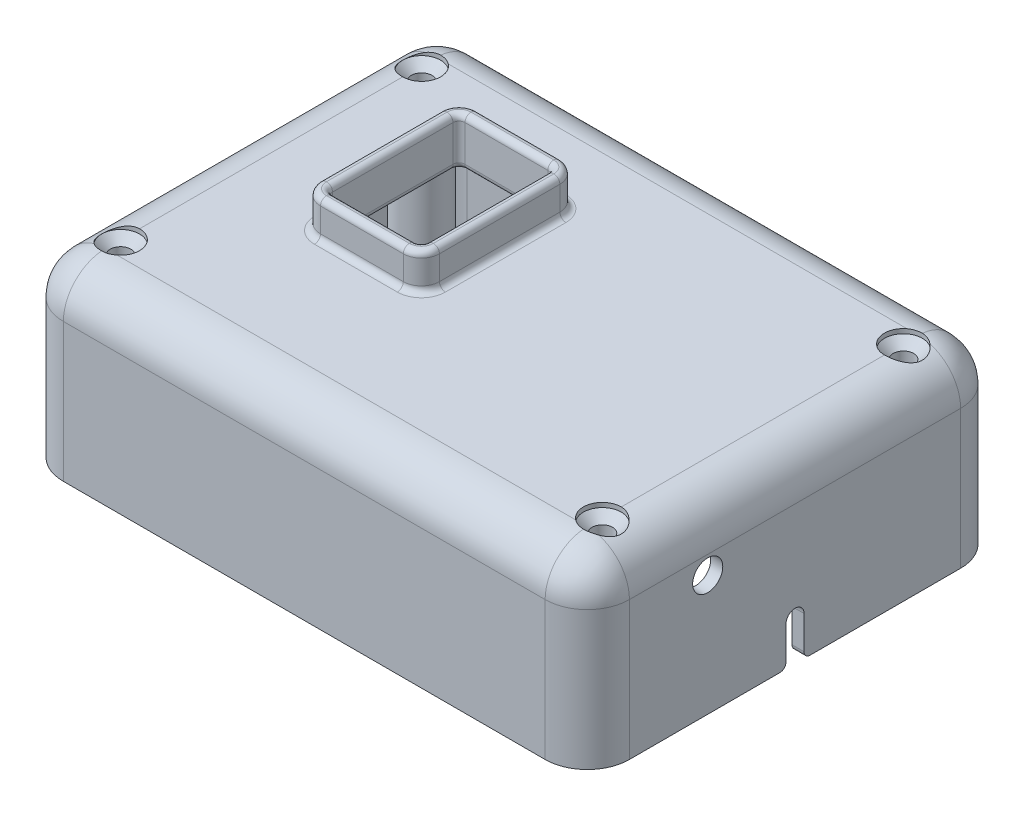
SolidWorks part; units mm, degrees
ref_plane "Front Plane" through (0, 0, 0) normal (0, 0, 1) x (1, 0, 0)
ref_plane "Top Plane" through (0, 0, 0) normal (0, 1, 0) x (1, 0, 0)
ref_plane "Right Plane" through (0, 0, 0) normal (1, 0, 0) x (0, 0, -1)
sketch "Sketch1" plane through (0, 0, 0) normal (0, 1, 0) x (1, 0, 0)
  line L1 (-47, -34.5) -> (47, -34.5)
  line L2 (-47, -34.5) -> (-47, 34.5)
  line L3 (-47, 34.5) -> (47, 34.5)
  line L4 (47, -34.5) -> (47, 34.5)
  line L5 (-47, -34.5) -> (47, 34.5) construction
  line L6 (-47, 34.5) -> (47, -34.5) construction
  point P0 (0, 0)
  dimension "D1" = 94
  dimension "D2" = 69
extrude "Boss-Extrude1" add sketch "Sketch1" along normal blind 30
fillet "Fillet1" radius 7 8 edges at (0, 30, 34.5) (-47, 30, 0) (0, 30, -34.5) (47, 30, 0) (-47, 15, -34.5) (47, 15, -34.5) (47, 15, 34.5) (-47, 15, 34.5)
shell "Shell1" thickness 2
sketch "Sketch2" plane through (47, 0, 0) normal (1, 0, 0) x (0, 0, -1)
  line L0 (-1.5, 6.5) -> (-1.5, 0)
  line L1 (-27.5, 0) -> (27.5, 0) construction
  line L2 (-1.5, 0) -> (1.5, 0)
  line L3 (1.5, 0) -> (1.5, 6.5)
  arc A0 (1.5, 6.5) -> (-1.5, 6.5) centre (0, 6.5) ccw
  point P7 (0, 0)
  dimension "D1" = 1.5
  dimension "D2" = 6.5
extrude "Cut-Extrude1" cut sketch "Sketch2" against normal blind 30
sketch "Sketch3" plane through (0, 0, 0) normal (0, -1, 0) x (1, 0, 0)
  circle A0 centre (40, -25) radius 4
  circle A1 centre (-40, -25) radius 4
  circle A2 centre (-40, 25) radius 4
  circle A3 centre (40, 25) radius 4
  dimension "D3" = 8
  dimension "D1" = 40
  dimension "D2" = 25
  dimension "D4" = 2
  dimension "D5" = 2
extrude "Boss-Extrude2" add sketch "Sketch3" against normal up to next
hole_wizard "CSK for M3 Flat Head Machine Screw1" positions "Sketch4" profile "Sketch5" countersink size "M3" standard "ANSI Metric"
sketch "Sketch4" plane through (0, 30, 0) normal (0, 1, 0) x (1, 0, 0)
  circle A0 centre (-40, 25) radius 4 construction
  circle A1 centre (-40, -25) radius 4 construction
  circle A2 centre (40, -25) radius 4 construction
  circle A3 centre (40, 25) radius 4 construction
  point P0 (-40, 25)
  point P2 (40, 25)
  point P4 (40, -25)
  point P6 (-40, -25)
sketch "Sketch5" plane through (-40, 30, -25) normal (1, 0, 0) x (0, 0, 1)
  line L0 (0, 0) -> (0, 30)
  line L1 (0, 30) -> (1.7, 30)
  line L2 (1.7, 30) -> (1.7, 2.2)
  line L3 (1.7, 2.2) -> (3.15, 0.75)
  line L4 (3.15, 0.75) -> (3.15, 0)
  line L6 (3.15, 0) -> (0, 0)
  line L7 (-1.7, 2.2) -> (-3.15, 0.75) construction
  line L11 (0, -6.35) -> (0, 107.95) construction
  dimension "Thru Hole Dia." = 3.4
  dimension "Thru Hole Depth" = 30
  dimension "C'Sink Dia." = 6.3
  dimension "C'Sink Angle" = 90
  dimension "Head Clearance" = 0.75
fillet "Fillet2" radius 1 2 edges at (46, 0, 1.5) (46, 0, -1.5)
sketch "Sketch6" plane through (0, 30, 0) normal (0, 1, 0) x (1, 0, 0)
  line L0 (40, 34.5) -> (-40, 34.5) construction
  line L1 (-8.5, 15.45) -> (-24.25, 15.45)
  line L2 (-8.5, 15.45) -> (-8.5, -6.55)
  line L3 (-8.5, -6.55) -> (-24.25, -6.55)
  line L4 (-24.25, 15.45) -> (-24.25, -6.55)
  line L5 (-47, 27.5) -> (-47, -27.5) construction
  dimension "D1" = 15.75
  dimension "D2" = 22
  dimension "D3" = 19.05
  dimension "D4" = 22.75
extrude "Cut-Extrude2" cut sketch "Sketch6" against normal up to next
sketch "Sketch7" plane through (0, 30, 0) normal (0, 1, 0) x (1, 0, 0)
  line L0 (-26.25, -8.55) -> (-26.25, 17.45)
  line L1 (-24.25, -6.55) -> (-8.5, -6.55)
  line L2 (-24.25, -6.55) -> (-24.25, 15.45)
  line L3 (-24.25, 15.45) -> (-8.5, 15.45)
  line L4 (-8.5, -6.55) -> (-8.5, 15.45)
  line L5 (-26.25, 17.45) -> (-6.5, 17.45)
  line L6 (-6.5, -8.55) -> (-6.5, 17.45)
  line L7 (-26.25, -8.55) -> (-6.5, -8.55)
  dimension "D1" = 2
extrude "Boss-Extrude3" add sketch "Sketch7" along normal blind 6
fillet "Fillet4" radius 3 4 edges at (-26.25, 33, -17.45) (-6.5, 33, -17.45) (-6.5, 33, 8.55) (-26.25, 33, 8.55)
fillet "Fillet3" radius 1 4 edges at (-8.5, 32, -15.45) (-24.25, 32, -15.45) (-24.25, 32, 6.55) (-8.5, 32, 6.55)
fillet "Fillet5" radius 1 32 edges at (-8.5, 28, -4.45) (-8.7929, 28, 6.2571) (-16.375, 28, 6.55) (-23.9571, 28, 6.2571) (-24.25, 28, -4.45) (-23.9571, 28, -15.1571) (-16.375, 28, -15.45) (-16.375, 30, -17.45) (-25.3713, 30, -16.5713) (-26.25, 30, -4.45) (-25.3713, 30, 7.6713) (-16.375, 30, 8.55) (-7.3787, 30, 7.6713) (-6.5, 30, -4.45) (-8.7929, 36, 6.2571) (-8.5, 36, -4.45) (-8.7929, 36, -15.1571) (-16.375, 36, -15.45) (-23.9571, 36, -15.1571) (-24.25, 36, -4.45) (-23.9571, 36, 6.2571) (-16.375, 36, 6.55) (-7.3787, 36, -16.5713) (-6.5, 36, -4.45) (-7.3787, 36, 7.6713) (-16.375, 36, 8.55) (-25.3713, 36, 7.6713) (-26.25, 36, -4.45) (-25.3713, 36, -16.5713) (-16.375, 36, -17.45) (-8.7929, 28, -15.1571) (-7.3787, 30, -16.5713)
sketch "Sketch9" plane through (0, 0, 0) normal (0, -1, 0) x (1, 0, 0)
  circle A0 centre (40, -25) radius 4
  circle A1 centre (-40, -25) radius 4
  circle A2 centre (-40, 25) radius 4
  circle A3 centre (40, 25) radius 4
  circle A4 centre (40, 25) radius 4 construction
  circle A5 centre (40, -25) radius 4 construction
  circle A6 centre (-40, -25) radius 4 construction
  circle A7 centre (-40, 25) radius 4 construction
extrude "Cut-Extrude3" cut sketch "Sketch9" against normal blind 5
sketch "Sketch10" plane through (0, 0, -34.5) normal (0, 0, -1) x (-1, 0, 0)
  line L0 (-20, 21.75) -> (-20, 10)
  line L1 (-40, 0) -> (40, 0) construction
  line L3 (-32.5, -7) -> (-7.5, -7)
  line L4 (-32.5, -7) -> (-32.5, 37)
  line L5 (-32.5, 37) -> (-7.5, 37)
  line L6 (-7.5, -7) -> (-7.5, 37)
  circle A0 centre (-20, 21.75) radius 2.125
  circle A1 centre (-20, 10) radius 2.125
  point P11 (-20, 37)
  dimension "D2" = 4.25
  dimension "D1" = 11.75
  dimension "D3" = 10
  dimension "D4" = 20
  dimension "D5" = 17
  dimension "D6" = 44
  dimension "D7" = 25
sketch "Sketch11" plane through (0, 0, 0) normal (0, -1, 0) x (1, 0, 0)
  line L0 (-40, -32.5) -> (40, -32.5) construction
  line L1 (-35, -32.5) -> (35, -32.5)
  line L2 (-35, -32.5) -> (-35, -34.5)
  line L3 (-35, -34.5) -> (35, -34.5)
  line L4 (35, -32.5) -> (35, -34.5)
  line L5 (40, -34.5) -> (-40, -34.5) construction
  point P8 (0, -32.5)
  dimension "D1" = 70
extrude "Boss-Extrude4" add sketch "Sketch11" along normal blind 10
fillet "Fillet6" radius 5 4 edges at (35, -10, -33.5) (35, 0, -33.5) (-35, -10, -33.5) (-35, 0, -33.5)
sketch "Sketch12" plane through (47, 0, 0) normal (1, 0, 0) x (0, 0, -1)
  line L0 (-27.5, 0) -> (-2.5, 0) construction
  line L1 (-34.5, 0) -> (-34.5, 23) construction
  circle A0 centre (-14.5, 20) radius 2.5
  dimension "D1" = 5
  dimension "D3" = 20
  dimension "D2" = 20
extrude "Cut-Extrude4" cut sketch "Sketch12" against normal blind 10
sketch "Sketch13" plane through (0, 0, -34.5) normal (0, 0, -1) x (-1, 0, 0)
  line L1 (-20, 6.15) -> (20, 6.15) construction
  line L2 (-20, 6.15) -> (-20, 18.85) construction
  line L3 (-20, 18.85) -> (20, 18.85) construction
  line L4 (20, 6.15) -> (20, 18.85) construction
  line L5 (-20, 6.15) -> (20, 18.85) construction
  line L6 (-20, 18.85) -> (20, 6.15) construction
  circle A0 centre (-20, 18.85) radius 1.875
  circle A1 centre (-20, 6.15) radius 1.875
  circle A2 centre (20, 6.15) radius 1.875
  circle A3 centre (20, 18.85) radius 1.875
  point P0 (0, 12.5)
  dimension "D4" = 3.75
  dimension "D1" = 12.7
  dimension "D2" = 40
  dimension "D3" = 12.5
extrude "Cut-Extrude5" cut sketch "Sketch13" against normal blind 10
ref_plane "Plane1" through (30, 0, 0) normal (1, 0, 0) x (0, 0, -1)
sketch "Sketch14" plane through (30, 0, 0) normal (1, 0, 0) x (0, 0, -1)
  line L0 (-32.5, 8) -> (-30, 8) construction
  line L1 (-30, 8) -> (-30, 24.6803) construction
  line L2 (-27.8468, 24.6803) -> (27.8468, 24.6803)
  line L3 (30, 24.6803) -> (30, 8) construction
  line L4 (30, 8) -> (32.5, 8) construction
  line L5 (32.5, 8) -> (32.5, 23)
  line L6 (27.5, 28) -> (-27.5, 28)
  line L7 (-32.5, 23) -> (-32.5, 8)
  line L8 (-21, 28) -> (21, 28) construction
  line L9 (-32.5, 0) -> (-32.5, 23) construction
  line L10 (32.5, 23) -> (32.5, 0) construction
  line L11 (-32.5, 8) -> (-30.3192, 22.5509)
  line L12 (32.5, 8) -> (30.3192, 22.5509)
  arc A0 (32.5, 23) -> (27.5, 28) centre (27.5, 23) ccw
  arc A1 (-27.5, 28) -> (-32.5, 23) centre (-27.5, 23) ccw
  arc A2 (-29, 27.7697) -> (-32.5, 23) centre (-27.5, 23) ccw construction
  arc A3 (32.5, 23) -> (29, 27.7697) centre (27.5, 23) ccw construction
  arc A4 (-30.3192, 22.5509) -> (-27.8468, 24.6803) centre (-27.8468, 22.1803) cw
  arc A5 (27.8468, 24.6803) -> (30.3192, 22.5509) centre (27.8468, 22.1803) cw
  dimension "D5" = 2.5
  dimension "D1" = 15
  dimension "D2" = 3.3197
  dimension "D3" = 2.5
  dimension "D4" = 2.5
extrude "Boss-Extrude5" add sketch "Sketch14" along normal mid plane 2
fillet "Fillet7" radius 0.5 22 edges at (30, 8, -32.5) (30, 8, 32.5) (31, 15.5, 32.5) (31, 26.5355, 31.0355) (31, 28, 0) (31, 26.5355, -31.0355) (31, 15.5, -32.5) (31, 15.2755, -31.4096) (31, 24.0746, -29.4783) (31, 24.6803, 0) (31, 24.0746, 29.4783) (31, 15.2755, 31.4096) (29, 24.0746, 29.4783) (29, 24.6803, 0) (29, 24.0746, -29.4783) (29, 15.2755, -31.4096) (29, 15.5, -32.5) (29, 26.5355, -31.0355) (29, 28, 0) (29, 26.5355, 31.0355) (29, 15.5, 32.5) (29, 15.2755, 31.4096)
pattern_linear "LPattern2" count 3 spacing 30 along (-1, 0, 0) of "Boss-Extrude5", "Fillet7"
